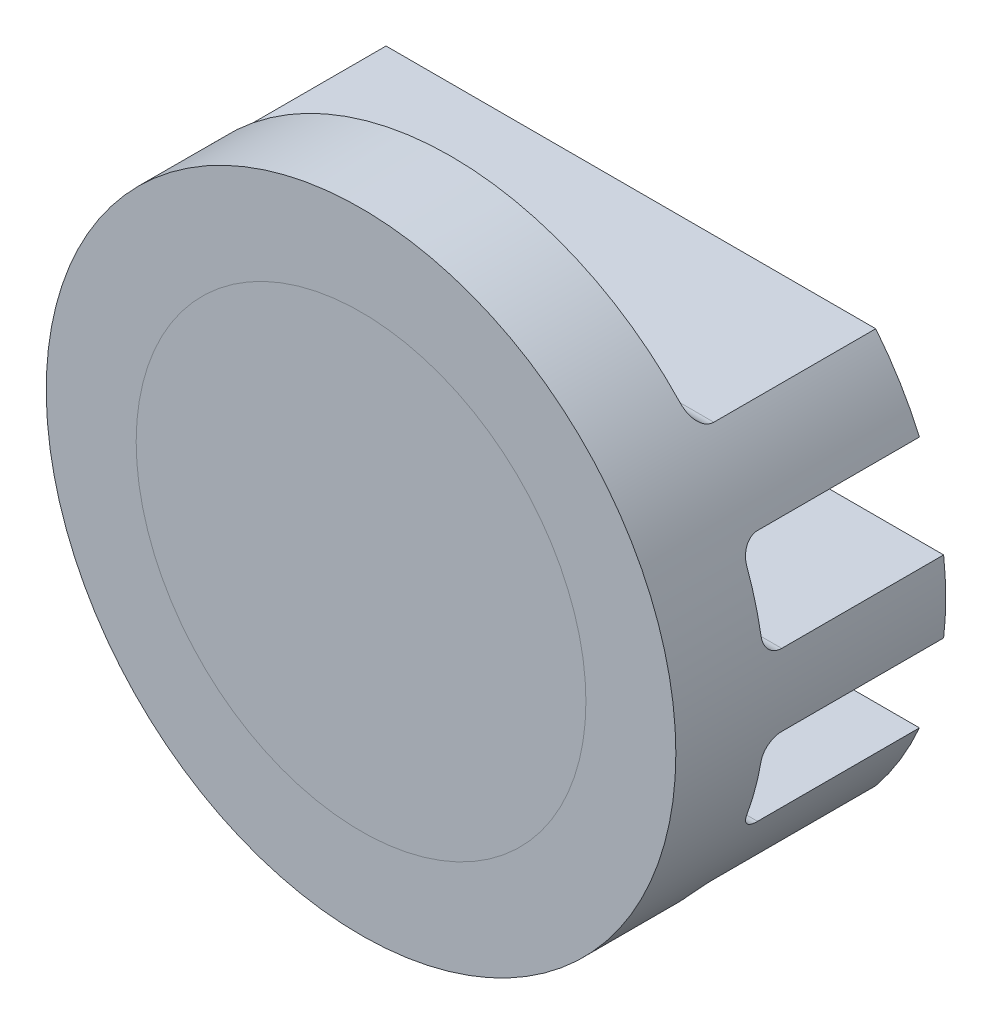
SolidWorks part; units mm, degrees
ref_plane "Front" through (0, 0, 0) normal (0, 0, 1) x (1, 0, 0)
ref_plane "Top" through (0, 0, 0) normal (0, 1, 0) x (1, 0, 0)
ref_plane "Right" through (0, 0, 0) normal (1, 0, 0) x (0, 0, -1)
sketch "Sketch1" plane through (0, 0, 0) normal (0, 0, 1) x (1, 0, 0)
  line L0 (0, 0) -> (53.3826, 0) construction
  line L5 (0, 46.8286) -> (0, 0) construction
  circle A0 centre (0, 0) radius 35
  dimension "D1" = 70
extrude "Base-Extrude" add sketch "Sketch1" along normal blind 10
sketch "Sketch6" plane through (0, 0, 0) normal (0, 0, -1) x (-1, 0, 0)
  line L0 (0, 0) -> (47.1642, 0) construction
  line L1 (0, 0) -> (0, 42.4167) construction
  line L3 (-43, -4) -> (43, -4)
  line L4 (-43, -4) -> (-43, 4)
  line L5 (-43, 4) -> (43, 4)
  line L6 (43, -4) -> (43, 4)
  dimension "D1" = 86
  dimension "D2" = 43
  dimension "D3" = 8
  dimension "D4" = 4
extrude "Extrude1" add sketch "Sketch6" along normal blind 20
pattern_linear "LPattern2" count 2 spacing 18 along (0, 1, 0) of "Extrude1"
mirror "Mirror1" about plane through (0, 0, 0) normal (0, 1, 0) of "LPattern2"
sketch "Sketch7" plane through (0, 0, 10) normal (0, 0, 1) x (1, 0, 0)
  circle A1 centre (0, 0) radius 35
  circle A2 centre (0, 0) radius 35
  dimension "D1" = 0
extrude "Cut-Extrude2" cut sketch "Sketch7" against normal through all flip side to cut
fillet "Fillet3" radius 2 6 edges at (0, 22, 0) (0, 4, 0) (0, -14, 0) (0, 14, 0) (0, -4, 0) (0, -22, 0)
sketch "Sketch9" plane through (0, 0, 10) normal (0, 0, 1) x (1, 0, 0)
  circle A0 centre (0, 0) radius 25
  dimension "D1" = 50
equation "\"D4@Sketch6\" = \"D3@Sketch6\"/2"
